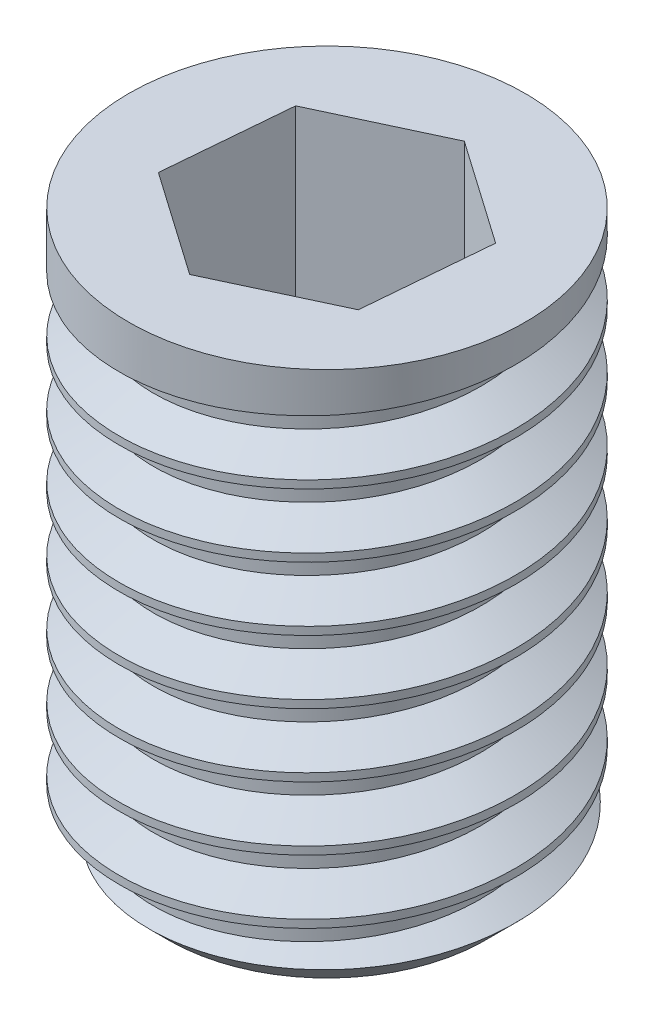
SolidWorks part; units mm, degrees
ref_plane "Спереди" through (0, 0, 0) normal (0, 0, 1) x (1, 0, 0)
ref_plane "Сверху" through (0, 0, 0) normal (0, 1, 0) x (1, 0, 0)
ref_plane "Справа" through (0, 0, 0) normal (1, 0, 0) x (0, 0, -1)
sketch "Эскиз1" plane through (0, 0, 0) normal (0, 1, 0) x (1, 0, 0)
  circle A0 centre (0, -0.2662) radius 2.5
  dimension "D1" = 5
extrude "Бобышка-Вытянуть1" add sketch "Эскиз1" along normal blind 7
sketch "Эскиз2" plane through (0, 7, 0) normal (0, 1, 0) x (1, 0, 0)
  line L1 (1.3115, -1.1827) -> (1.4495, 0.4113)
  line L2 (1.4495, 0.4113) -> (0.1379, 1.3278)
  line L3 (0.1379, 1.3278) -> (-1.3115, 0.6503)
  line L4 (-1.3115, 0.6503) -> (-1.4495, -0.9438)
  line L5 (-1.4495, -0.9438) -> (-0.1379, -1.8603)
  line L6 (-0.1379, -1.8603) -> (1.3115, -1.1827)
  circle A0 centre (0, -0.2662) radius 1.6 construction
  dimension "D1" = 3.2
extrude "Вырез-Вытянуть1" cut sketch "Эскиз2" against normal blind 3
thread "Резьба1" pitch 0.8 start angle 0, offset 0, length 6.5, pitch 0.8, diameter 5
ref_plane "Плоскость1" through (-2.5, 7, 0.2662) normal (0, 0, 1) x (-1, 0, 0)
sketch "Профиль резьбы1" plane through (-2.5, 7, 0.2662) normal (0, 0, 1) x (-1, 0, 0)
  line L0 (0, 0) -> (0, 0.8) construction
  line L11 (0, 0) -> (0, 0.7)
  line L12 (0, 0.7) -> (-0.433, 0.45)
  line L13 (-0.433, 0.45) -> (-0.433, 0.25)
  line L15 (-0.433, 0.25) -> (0, 0)
  line L17 (-0.433, 0.35) -> (0, 0.35) construction
  point P2 (0, 0)
  dimension "Pitch" = 0.8
  dimension "Profile_Angle" = 60
  dimension "Profile_Land" = 0.2
  dimension "Profile_Height" = 0.433
chamfer "Фаска1" distance 0.5 angle 45 1 edges
